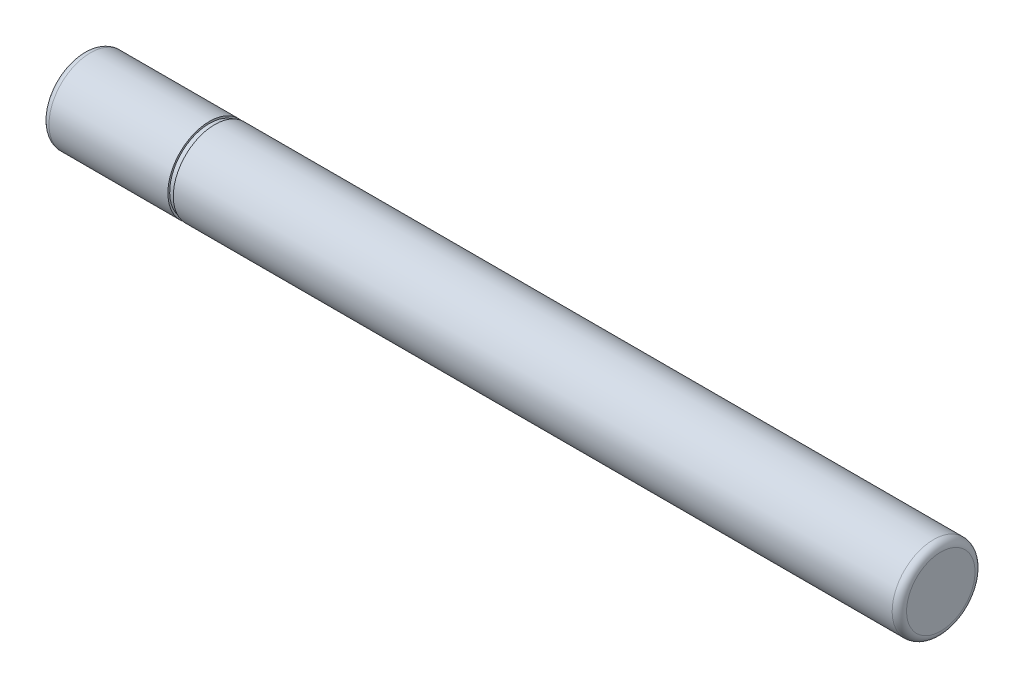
SolidWorks part; units mm, degrees
ref_plane "Plan de face" through (0, 0, 0) normal (0, 0, 1) x (1, 0, 0)
ref_plane "Plan de dessus" through (0, 0, 0) normal (0, 1, 0) x (1, 0, 0)
ref_plane "Plan de droite" through (0, 0, 0) normal (1, 0, 0) x (0, 0, -1)
sketch "Esquisse1" plane through (0, 0, 0) normal (0, 0, 1) x (1, 0, 0)
  line L0 (0, 0) -> (-201, 0)
  line L1 (-201, 0) -> (-201, 5)
  line L2 (-201, 5) -> (0, 5)
  line L3 (0, 5) -> (0, 8)
  line L4 (0, 8) -> (-1, 8)
  line L5 (-1, 8) -> (-1, 11.5)
  line L6 (-1, 11.5) -> (34, 11.5)
  line L7 (237, 11.5) -> (237, 0)
  line L8 (237, 0) -> (0, 0)
  line L9 (34, 11.5) -> (34, 11)
  line L10 (34, 11) -> (35.5, 11)
  line L11 (35.5, 11) -> (35.5, 11.5)
  line L12 (35.5, 11.5) -> (237, 11.5)
  dimension "D1" = 5
  dimension "D2" = 11.5
  dimension "D3" = 200
  dimension "D4" = 201
  dimension "D5" = 3.5
  dimension "D6" = 438
  dimension "D7" = 0.5
  dimension "D8" = 1.5
  dimension "D9" = 35
revolve "Révolution1" add sketch "Esquisse1" angle 360 mid plane about L0
fillet "Congé1" radius 2 2 edges at (-1, 11.5, 0) (237, 11.5, 0)
sketch "Esquisse2" plane through (0, 0, 0) normal (-1, 0, 0) x (0, 0, 1)
  circle A1 centre (0, 0) radius 8
  circle A2 centre (0, 0) radius 8
  dimension "D1" = 0
extrude "Enlèv. mat.-Extru.1" cut sketch "Esquisse2" along normal blind 500
